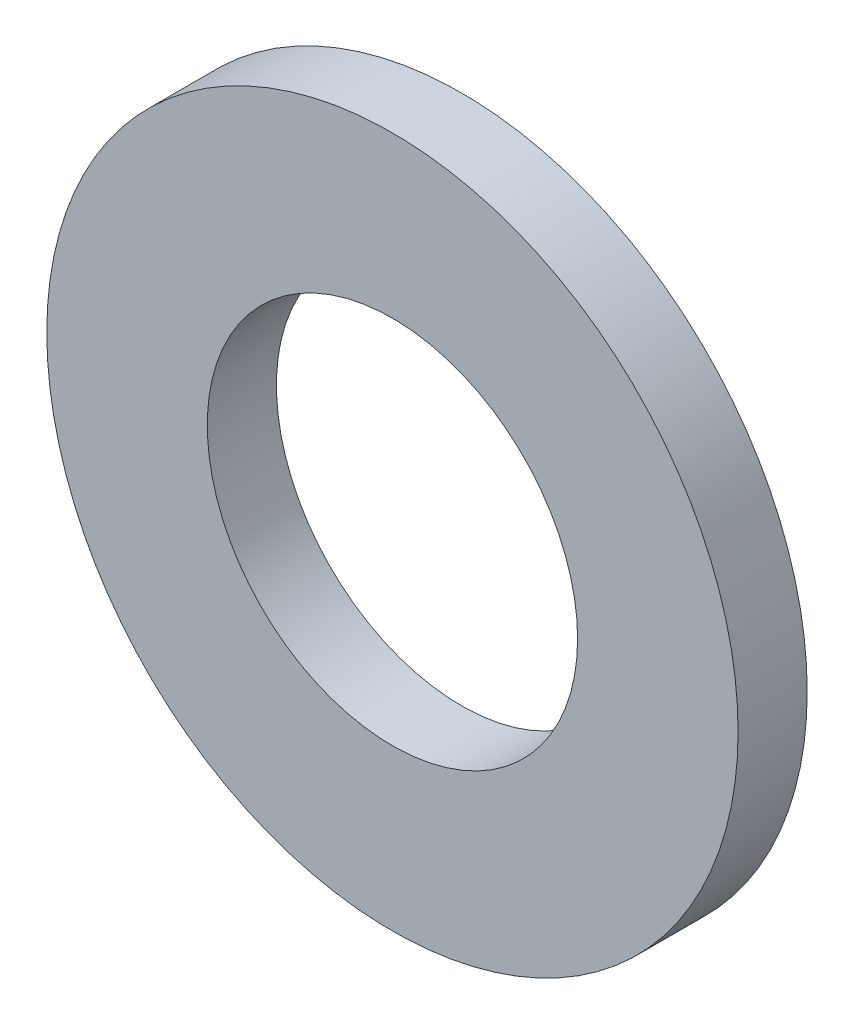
SolidWorks part; units mm, degrees
ref_plane "Plan1" through (0, 0, 0) normal (0, 0, 1) x (1, 0, 0)
ref_plane "Plan2" through (0, 0, 0) normal (0, 1, 0) x (1, 0, 0)
ref_plane "Plan3" through (0, 0, 0) normal (1, 0, 0) x (0, 0, -1)
sketch "Esquisse1" plane through (0, 0, 0) normal (0, 0, 1) x (1, 0, 0)
  circle A0 centre (0, 0) radius 14
  circle A1 centre (0, 0) radius 7.5
  dimension "D1" = 28
  dimension "D2" = 15
extrude "Base-Extrusion" add sketch "Esquisse1" against normal blind 2.8
